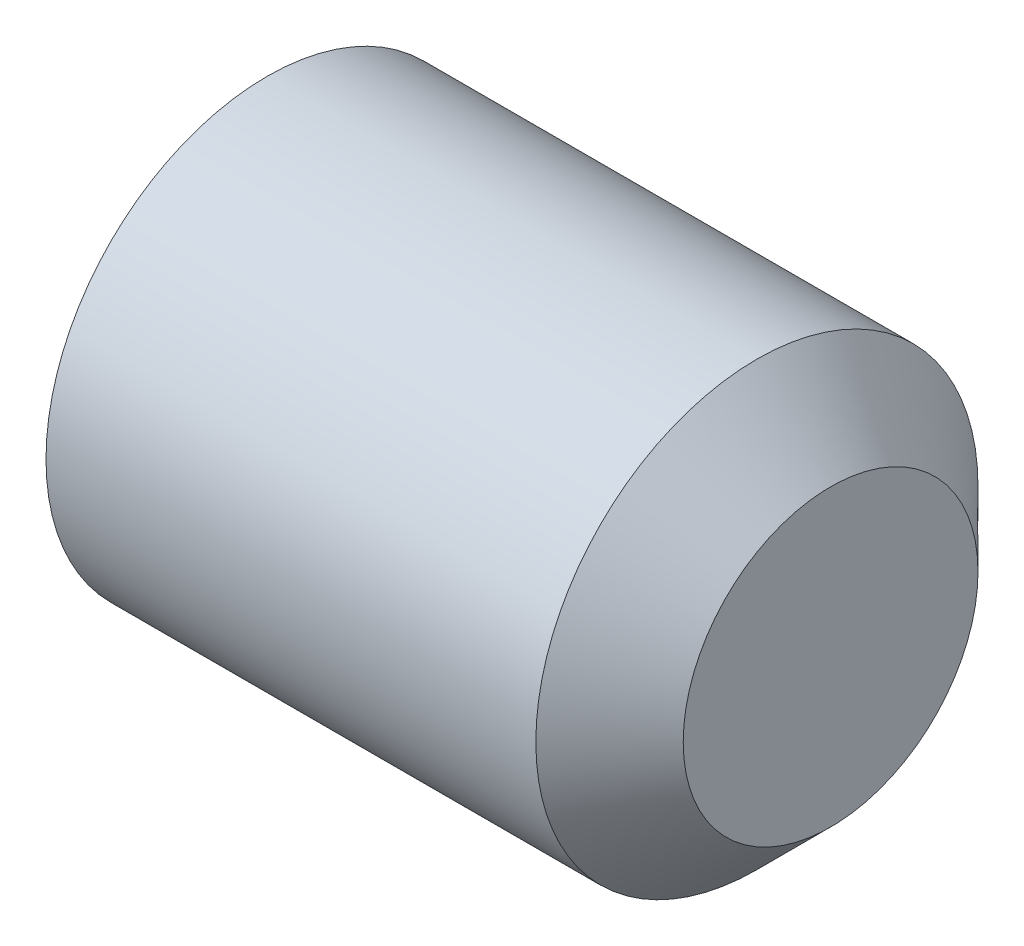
SolidWorks part; units mm, degrees
ref_plane "Front Plane" through (0, 0, 0) normal (0, 0, 1) x (1, 0, 0)
ref_plane "Top Plane" through (0, 0, 0) normal (0, 1, 0) x (1, 0, 0)
ref_plane "Right Plane" through (0, 0, 0) normal (1, 0, 0) x (0, 0, -1)
ref_plane "Plane1" through (-4, 0, 0) normal (1, 0, 0) x (0, 0, -1)
sketch "Sketch1" plane through (0, 0, 0) normal (0, 0, 1) x (1, 0, 0)
  line L0 (-4, 0) -> (0, 0) construction
  line L1 (0, 0) -> (0, 1)
  line L2 (-0.5, 1.5) -> (-3.8233, 1.5)
  line L3 (-4, 1.194) -> (-4, 0)
  line L4 (-4, 0) -> (0, 0)
  line L5 (0, 1) -> (-0.5, 1.5)
  line L6 (-4, 1.194) -> (-3.8233, 1.5)
  point P4 (0, -1)
  point P6 (-3.8233, -1.5)
  point P11 (-4, -1.194)
  dimension "FIX_1" = 60
  dimension "FIX_2" = 45
  dimension "MSM_21" = 2
revolve "Revolve1" add sketch "Sketch1" angle 360 about L0
sketch "Sketch2" plane through (-4, 0, 0) normal (1, 0, 0) x (0, 0, -1)
  line L1 (0.75, -0.433) -> (0.75, 0.433)
  line L2 (0.75, 0.433) -> (0, 0.866)
  line L3 (0, 0.866) -> (-0.75, 0.433)
  line L4 (-0.75, 0.433) -> (-0.75, -0.433)
  line L5 (-0.75, -0.433) -> (0, -0.866)
  line L6 (0, -0.866) -> (0.75, -0.433)
  circle A0 centre (0, 0) radius 0.75 construction
extrude "Cut-Extrude1" cut sketch "Sketch2" along normal blind 1.2
equation "\"KSS_1\"= IIF ( ( \"M_1\" = 4 ) , 3.142 , IIF ( ( \"M_1\" = 3 ) , 2.388 , 4.02 ) )"
